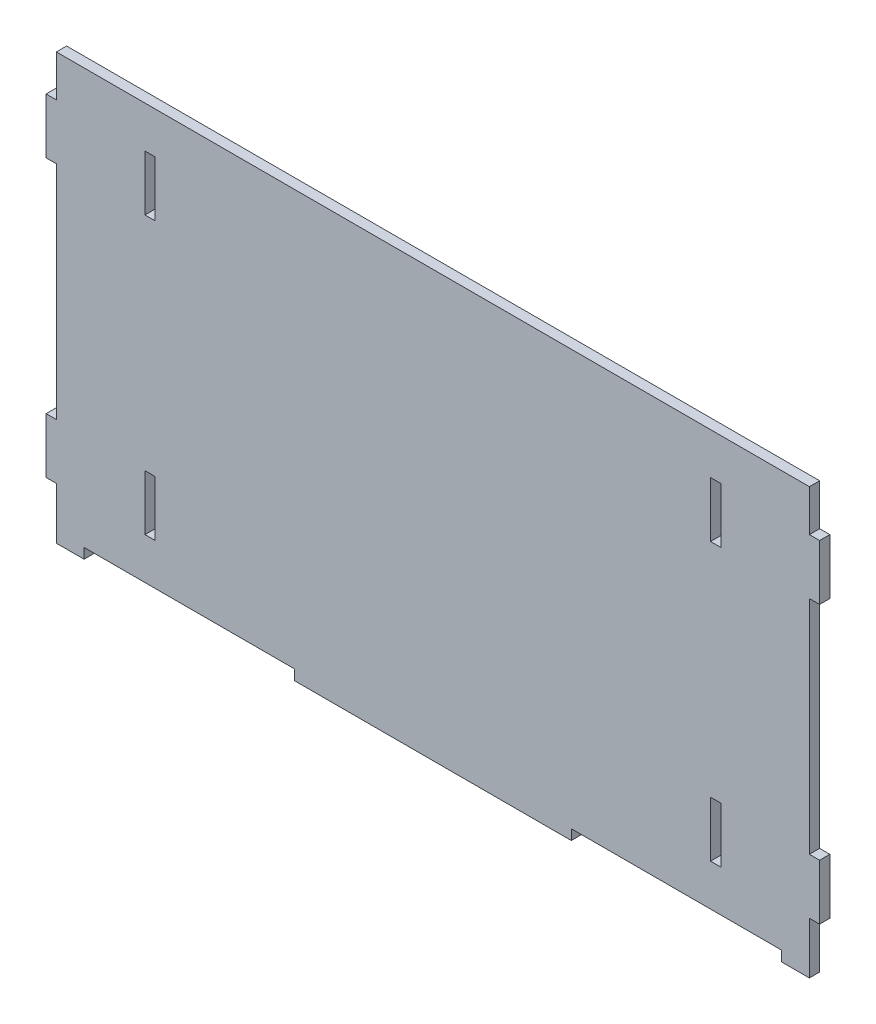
SolidWorks part; units mm, degrees
ref_plane "Front Plane" through (0, 0, 0) normal (0, 0, 1) x (1, 0, 0)
ref_plane "Top Plane" through (0, 0, 0) normal (0, 1, 0) x (1, 0, 0)
ref_plane "Right Plane" through (0, 0, 0) normal (1, 0, 0) x (0, 0, -1)
sketch "Sketch1" plane through (0, 0, 0) normal (0, 0, 1) x (1, 0, 0)
  line L0 (-100.3, 38.7) -> (-100.3, 18.7)
  line L1 (-136, 153.7) -> (136, 153.7)
  line L2 (-136, 153.7) -> (-136, 138.7)
  line L3 (126, 0) -> (136, 0)
  line L4 (136, 153.7) -> (136, 138.7)
  line L5 (-104, 138.7) -> (-100.3, 138.7)
  line L6 (-104, 138.7) -> (-104, 118.7)
  line L7 (-104, 18.7) -> (-100.3, 18.7)
  line L8 (-100.3, 138.7) -> (-100.3, 118.7)
  line L9 (-104, 118.7) -> (-100.3, 118.7)
  line L10 (-104, 38.7) -> (-104, 18.7)
  line L11 (-104, 38.7) -> (-100.3, 38.7)
  line L12 (100.3, 38.7) -> (100.3, 18.7)
  line L13 (100.3, 138.7) -> (104, 138.7)
  line L14 (100.3, 138.7) -> (100.3, 118.7)
  line L15 (100.3, 18.7) -> (104, 18.7)
  line L16 (104, 138.7) -> (104, 118.7)
  line L17 (100.3, 118.7) -> (104, 118.7)
  line L18 (104, 38.7) -> (104, 18.7)
  line L19 (100.3, 38.7) -> (104, 38.7)
  line L20 (0, 0) -> (-100.3, 18.7) construction
  line L21 (0, 0) -> (100.3, 18.7) construction
  line L22 (136, 118.7) -> (136, 38.7)
  line L23 (136, 138.7) -> (139.7, 138.7)
  line L24 (-50, 0) -> (50, 0)
  line L25 (136, 118.7) -> (139.7, 118.7)
  line L26 (139.7, 138.7) -> (139.7, 118.7)
  line L27 (136, 38.7) -> (139.7, 38.7)
  line L28 (-126, 0) -> (-126, 3.7)
  line L29 (136, 18.7) -> (139.7, 18.7)
  line L30 (139.7, 38.7) -> (139.7, 18.7)
  line L31 (-136, 138.7) -> (-139.7, 138.7)
  line L32 (-126, 3.7) -> (-50, 3.7)
  line L33 (-136, 118.7) -> (-139.7, 118.7)
  line L34 (-139.7, 138.7) -> (-139.7, 118.7)
  line L35 (-136, 38.7) -> (-139.7, 38.7)
  line L36 (-50, 0) -> (-50, 3.7)
  line L37 (-136, 18.7) -> (-139.7, 18.7)
  line L38 (-139.7, 38.7) -> (-139.7, 18.7)
  line L39 (136, 18.7) -> (136, 0)
  line L40 (-136, 18.7) -> (-136, 0)
  line L41 (-136, 118.7) -> (-136, 38.7)
  line L42 (-100.3, 118.7) -> (0, 0) construction
  line L43 (50, 0) -> (50, 3.7)
  line L44 (50, 3.7) -> (126, 3.7)
  line L45 (126, 0) -> (126, 3.7)
  line L46 (0, 0) -> (100.3, 118.7) construction
  line L53 (-136, 0) -> (-126, 0)
  dimension "D11" = 150
  dimension "D1" = 3.7
  dimension "D2" = 20
  dimension "D3" = 15
  dimension "D4" = 32
  dimension "D5" = 10
  dimension "D6" = 3.7
  dimension "D7" = 153.7
  dimension "D8" = 100
  dimension "D9" = 3.7
  dimension "D10" = 80
  dimension "D16" = 272
extrude "Extrude1" add sketch "Sketch1" along normal blind 3.7
